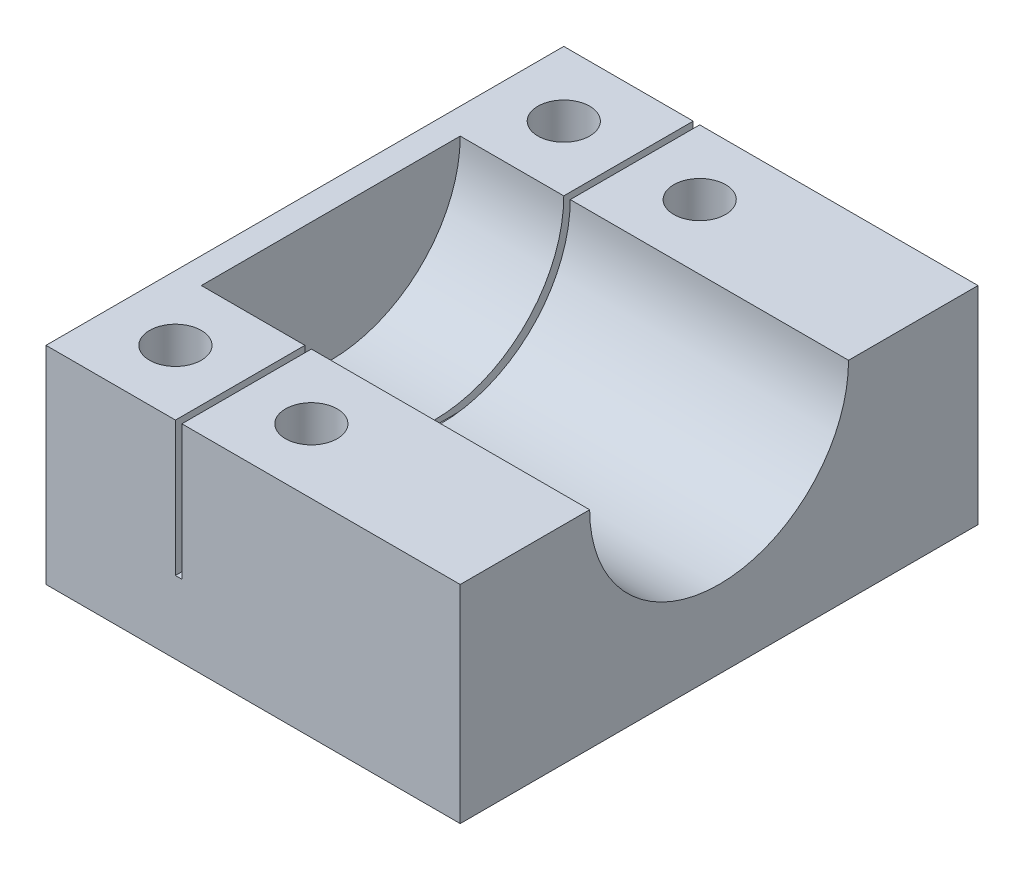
SolidWorks part; units mm, degrees
ref_plane "Front Plane" through (0, 0, 0) normal (0, 0, 1) x (1, 0, 0)
ref_plane "Top Plane" through (0, 0, 0) normal (0, 1, 0) x (1, 0, 0)
ref_plane "Right Plane" through (0, 0, 0) normal (1, 0, 0) x (0, 0, -1)
sketch "Sketch1" plane through (0, 0, 0) normal (0, 1, 0) x (1, 0, 0)
  line L1 (0, 0) -> (101.6, 0)
  line L2 (0, 0) -> (0, 127)
  line L3 (0, 127) -> (101.6, 127)
  line L4 (101.6, 0) -> (101.6, 127)
  dimension "D1" = 127
  dimension "D2" = 101.6
extrude "Boss-Extrude1" add sketch "Sketch1" along normal blind 50.8
sketch "Sketch3" plane through (101.6, 0, 0) normal (1, 0, 0) x (0, 0, -1)
  line L4 (0, 0) -> (127, 0)
  line L5 (127, 0) -> (127, 50.8)
  line L6 (127, 50.8) -> (0, 50.8)
  line L7 (0, 50.8) -> (0, 0)
  line L8 (0, 0) -> (127, 0) construction
  line L9 (127, 0) -> (127, 50.8) construction
  line L10 (127, 50.8) -> (0, 50.8) construction
  line L11 (0, 50.8) -> (0, 0) construction
  circle A0 centre (63.5, 50.8) radius 31.75
  dimension "D2" = 63.5
  dimension "D1" = 0
extrude "Cut-Extrude1" cut sketch "Sketch3" against normal blind 95.25 and the other way through all
sketch "Sketch7" plane through (0, 50.8, 0) normal (0, 1, 0) x (1, 0, 0)
  line L1 (31.75, 127) -> (33.3375, 127)
  line L2 (31.75, 127) -> (31.75, 0)
  line L3 (31.75, 0) -> (33.3375, 0)
  line L4 (33.3375, 127) -> (33.3375, 0)
  line L8 (0, 0) -> (101.6, 0) construction
  line L10 (6.35, 95.25) -> (101.6, 95.25)
  line L11 (101.6, 95.25) -> (101.6, 127)
  line L12 (101.6, 127) -> (0, 127)
  line L13 (0, 127) -> (0, 0)
  line L18 (6.35, 95.25) -> (101.6, 95.25) construction
  line L20 (101.6, 127) -> (0, 127) construction
  line L21 (0, 127) -> (0, 0) construction
  line L45 (101.6, 31.75) -> (6.35, 31.75)
  line L46 (101.6, 31.75) -> (6.35, 31.75)
  line L47 (6.35, 31.75) -> (6.35, 95.25)
  line L48 (6.35, 31.75) -> (6.35, 95.25)
  line L49 (0, 0) -> (101.6, 0)
  line L50 (0, 0) -> (101.6, 0)
  line L51 (101.6, 0) -> (101.6, 31.75)
  point P0 (38.1, 0)
  dimension "D2" = 25.4
  dimension "D3" = 1.5875
  dimension "D1" = 0
extrude "Cut-Extrude4" cut sketch "Sketch7" against normal blind 33.02 contours L4 L2 M21 M27 | L4 L2 M23 M21 | L4 L2 M25 M23
sketch "Sketch8" plane through (0, 0, 0) normal (0, -1, 0) x (1, 0, 0)
  line L0 (101.6, -31.75) -> (33.3375, -31.75) construction
  line L1 (33.3375, -31.75) -> (33.3375, 0) construction
  line L2 (33.3375, 0) -> (101.6, 0) construction
  line L3 (101.6, 0) -> (101.6, -31.75) construction
  line L4 (0, 0) -> (0, -127)
  line L5 (0, -127) -> (101.6, -127)
  line L6 (101.6, -127) -> (101.6, 0)
  line L7 (101.6, 0) -> (0, 0)
  line L8 (0, 0) -> (0, -127) construction
  line L9 (0, -127) -> (101.6, -127) construction
  line L10 (101.6, -127) -> (101.6, 0) construction
  line L11 (101.6, 0) -> (0, 0) construction
  line L12 (101.6, -127) -> (33.3375, -127) construction
  line L13 (33.3375, -127) -> (33.3375, -95.25) construction
  line L14 (33.3375, -95.25) -> (101.6, -95.25) construction
  line L15 (101.6, -95.25) -> (101.6, -127) construction
  line L16 (31.75, 0) -> (0, 0)
  line L17 (6.35, -31.75) -> (31.75, -31.75)
  line L18 (6.35, -31.75) -> (31.75, -31.75) construction
  line L19 (6.35, -95.25) -> (6.35, -31.75)
  line L20 (6.35, -95.25) -> (6.35, -31.75) construction
  line L21 (31.75, -31.75) -> (31.75, 0)
  line L22 (31.75, -31.75) -> (31.75, 0) construction
  line L24 (31.75, 0) -> (0, 0) construction
  line L32 (101.6, -31.75) -> (33.3375, -31.75) construction
  line L33 (33.3375, -31.75) -> (33.3375, 0) construction
  line L34 (33.3375, 0) -> (101.6, 0) construction
  line L35 (101.6, 0) -> (101.6, -31.75) construction
  line L36 (101.6, -127) -> (33.3375, -127) construction
  line L37 (33.3375, -127) -> (33.3375, -95.25) construction
  line L38 (33.3375, -95.25) -> (101.6, -95.25) construction
  line L39 (101.6, -95.25) -> (101.6, -127) construction
  line L40 (0, -15.875) -> (101.6, -15.875) construction
  line L41 (0, -111.125) -> (101.6, -111.125) construction
  line L43 (6.35, -10.3757) -> (6.35, -21.3743)
  line L44 (6.35, -21.3743) -> (15.875, -26.8735)
  line L45 (15.875, -26.8735) -> (25.4, -21.3743)
  line L46 (25.4, -21.3743) -> (25.4, -10.3757)
  line L47 (25.4, -10.3757) -> (15.875, -4.8765)
  line L48 (15.875, -4.8765) -> (6.35, -10.3757)
  line L49 (6.35, -105.6257) -> (6.35, -116.6243)
  line L50 (6.35, -116.6243) -> (15.875, -122.1235)
  line L51 (15.875, -122.1235) -> (25.4, -116.6243)
  line L52 (25.4, -116.6243) -> (25.4, -105.6257)
  line L53 (25.4, -105.6257) -> (15.875, -100.1265)
  line L54 (15.875, -100.1265) -> (6.35, -105.6257)
  line L55 (49.2125, -4.8765) -> (39.6875, -10.3757)
  line L56 (39.6875, -10.3757) -> (39.6875, -21.3743)
  line L57 (39.6875, -21.3743) -> (49.2125, -26.8735)
  line L58 (49.2125, -26.8735) -> (58.7375, -21.3743)
  line L59 (58.7375, -21.3743) -> (58.7375, -10.3757)
  line L60 (58.7375, -10.3757) -> (49.2125, -4.8765)
  line L61 (39.6875, -105.6257) -> (39.6875, -116.6243)
  line L62 (39.6875, -116.6243) -> (49.2125, -122.1235)
  line L63 (49.2125, -122.1235) -> (58.7375, -116.6243)
  line L64 (58.7375, -116.6243) -> (58.7375, -105.6257)
  line L65 (58.7375, -105.6257) -> (49.2125, -100.1265)
  line L66 (49.2125, -100.1265) -> (39.6875, -105.6257)
  line L73 (31.75, -95.25) -> (6.35, -95.25)
  line L74 (31.75, -95.25) -> (6.35, -95.25) construction
  line L75 (31.75, -127) -> (31.75, -95.25)
  line L76 (31.75, -127) -> (31.75, -95.25) construction
  line L77 (0, -127) -> (31.75, -127)
  line L78 (0, -127) -> (31.75, -127)
  line L79 (0, 0) -> (0, -127)
  line L80 (0, 0) -> (0, -127)
  circle A0 centre (15.875, -15.875) radius 9.525 construction
  circle A1 centre (15.875, -111.125) radius 9.525 construction
  circle A2 centre (49.2125, -15.875) radius 9.525 construction
  circle A3 centre (49.2125, -111.125) radius 9.525 construction
  point P2 (31.75, -15.875)
  point P11 (31.75, -111.125)
  point P22 (50.8, -111.125)
  point P24 (50.8, -15.875)
  point P46 (0, 0)
  dimension "D3" = 15.875
  dimension "D4" = 15.875
  dimension "D5" = 19.05
  dimension "D6" = 19.05
  dimension "D7" = 15.875
  dimension "D1" = 0
  dimension "D2" = 0
extrude "Cut-Extrude5" cut sketch "Sketch8" against normal blind 6.35 contours L47 L48 L43 L44 L45 L46 | L59 L60 L55 L56 L57 L58 | L65 L66 L61 L62 L63 L64 | L53 L54 L49 L50 L51 L52
sketch "Sketch10" plane through (0, 0, 0) normal (0, -1, 0) x (1, 0, 0)
  line L0 (25.4, -105.6257) -> (15.875, -100.1265) construction
  line L1 (15.875, -100.1265) -> (6.35, -105.6257) construction
  line L2 (6.35, -105.6257) -> (6.35, -116.6243) construction
  line L3 (6.35, -116.6243) -> (15.875, -122.1235) construction
  line L4 (15.875, -122.1235) -> (25.4, -116.6243) construction
  line L5 (25.4, -116.6243) -> (25.4, -105.6257) construction
  line L6 (58.7375, -105.6257) -> (49.2125, -100.1265) construction
  line L7 (49.2125, -100.1265) -> (39.6875, -105.6257) construction
  line L8 (39.6875, -105.6257) -> (39.6875, -116.6243) construction
  line L9 (39.6875, -116.6243) -> (49.2125, -122.1235) construction
  line L10 (49.2125, -122.1235) -> (58.7375, -116.6243) construction
  line L11 (58.7375, -116.6243) -> (58.7375, -105.6257) construction
  line L12 (58.7375, -21.3743) -> (58.7375, -10.3757) construction
  line L13 (58.7375, -10.3757) -> (49.2125, -4.8765) construction
  line L14 (49.2125, -4.8765) -> (39.6875, -10.3757) construction
  line L15 (39.6875, -10.3757) -> (39.6875, -21.3743) construction
  line L16 (39.6875, -21.3743) -> (49.2125, -26.8735) construction
  line L17 (49.2125, -26.8735) -> (58.7375, -21.3743) construction
  line L18 (25.4, -10.3757) -> (15.875, -4.8765) construction
  line L19 (15.875, -4.8765) -> (6.35, -10.3757) construction
  line L20 (6.35, -10.3757) -> (6.35, -21.3743) construction
  line L21 (6.35, -21.3743) -> (15.875, -26.8735) construction
  line L22 (15.875, -26.8735) -> (25.4, -21.3743) construction
  line L23 (25.4, -21.3743) -> (25.4, -10.3757) construction
  line L24 (25.4, -105.6257) -> (15.875, -100.1265) construction
  line L25 (15.875, -100.1265) -> (6.35, -105.6257) construction
  line L26 (6.35, -105.6257) -> (6.35, -116.6243) construction
  line L27 (6.35, -116.6243) -> (15.875, -122.1235) construction
  line L28 (15.875, -122.1235) -> (25.4, -116.6243) construction
  line L29 (25.4, -116.6243) -> (25.4, -105.6257) construction
  line L30 (58.7375, -105.6257) -> (49.2125, -100.1265) construction
  line L31 (49.2125, -100.1265) -> (39.6875, -105.6257) construction
  line L32 (39.6875, -105.6257) -> (39.6875, -116.6243) construction
  line L33 (39.6875, -116.6243) -> (49.2125, -122.1235) construction
  line L34 (49.2125, -122.1235) -> (58.7375, -116.6243) construction
  line L35 (58.7375, -116.6243) -> (58.7375, -105.6257) construction
  line L36 (58.7375, -21.3743) -> (58.7375, -10.3757) construction
  line L37 (58.7375, -10.3757) -> (49.2125, -4.8765) construction
  line L38 (49.2125, -4.8765) -> (39.6875, -10.3757) construction
  line L39 (39.6875, -10.3757) -> (39.6875, -21.3743) construction
  line L40 (39.6875, -21.3743) -> (49.2125, -26.8735) construction
  line L41 (49.2125, -26.8735) -> (58.7375, -21.3743) construction
  line L42 (25.4, -10.3757) -> (15.875, -4.8765) construction
  line L43 (15.875, -4.8765) -> (6.35, -10.3757) construction
  line L44 (6.35, -10.3757) -> (6.35, -21.3743) construction
  line L45 (6.35, -21.3743) -> (15.875, -26.8735) construction
  line L46 (15.875, -26.8735) -> (25.4, -21.3743) construction
  line L47 (25.4, -21.3743) -> (25.4, -10.3757) construction
  line L48 (6.35, -21.3743) -> (25.4, -10.3757) construction
  line L49 (39.6875, -21.3743) -> (58.7375, -10.3757) construction
  line L50 (6.35, -116.6243) -> (25.4, -105.6257) construction
  line L51 (39.6875, -116.6243) -> (58.7375, -105.6257) construction
  circle A0 centre (15.875, -111.125) radius 6.35
  circle A1 centre (49.2125, -111.125) radius 6.35
  circle A2 centre (49.2125, -15.875) radius 6.35
  circle A3 centre (15.875, -15.875) radius 6.35
  dimension "D1" = 12.7
extrude "Cut-Extrude7" cut sketch "Sketch10" against normal through all both
